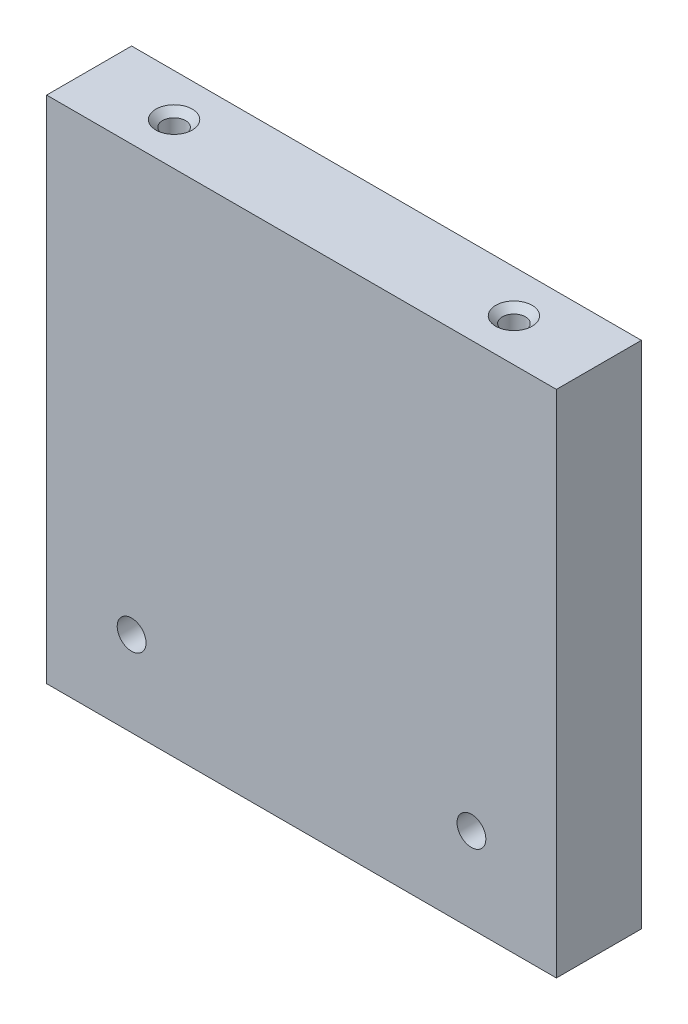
SolidWorks part; units mm, degrees
ref_plane "Front Plane" through (0, 0, 0) normal (0, 0, 1) x (1, 0, 0)
ref_plane "Top Plane" through (0, 0, 0) normal (0, 1, 0) x (1, 0, 0)
ref_plane "Right Plane" through (0, 0, 0) normal (1, 0, 0) x (0, 0, -1)
sketch "Sketch1" plane through (0, 0, 0) normal (0, 0, 1) x (1, 0, 0)
  line L1 (-83.6107, 61.7113) -> (-7.4107, 61.7113)
  line L2 (-83.6107, 61.7113) -> (-83.6107, -14.4887)
  line L3 (-83.6107, -14.4887) -> (-7.4107, -14.4887)
  line L4 (-7.4107, 61.7113) -> (-7.4107, -14.4887)
  line L5 (-83.6107, 61.7113) -> (-7.4107, -14.4887) construction
  line L6 (-83.6107, -14.4887) -> (-7.4107, 61.7113) construction
  point P0 (-45.5107, 23.6113)
  dimension "D1" = 76.2
  dimension "D2" = 76.2
extrude "Boss-Extrude1" add sketch "Sketch1" along normal blind 12.7 contours L2 L1 L4 L3
hole_wizard "#8-32 Tapped Hole2" positions "Sketch6" profile "Sketch5" tap size "#8-32" standard "ANSI Inch"
sketch "Sketch6" plane through (0, 61.7113, 0) normal (0, 1, 0) x (1, 0, 0)
  line L0 (-83.6107, 0) -> (-7.4107, 0) construction
  line L1 (-83.6107, -12.7) -> (-83.6107, 0) construction
  line L2 (-7.4107, -12.7) -> (-7.4107, 0) construction
  point P0 (-70.9107, -6.35)
  point P2 (-20.1107, -6.35)
  dimension "D1" = 6.35
  dimension "D2" = 12.7
  dimension "D3" = 6.35
  dimension "D4" = 12.7
sketch "Sketch5" plane through (-70.9107, 61.7113, 6.35) normal (1, 0, 0) x (0, 0, 1)
  line L0 (0, 0) -> (0, 7.3878)
  line L1 (0, 7.3878) -> (1.7272, 6.35)
  line L2 (1.7272, 6.35) -> (1.7272, 0.9906)
  line L3 (1.7272, 0.9906) -> (2.7178, 0)
  line L5 (2.7178, 0) -> (0, 0)
  line L6 (-1.7272, 0.9906) -> (-2.7178, 0) construction
  line L10 (0, 7.3878) -> (-1.7272, 6.35) construction
  line L11 (0, -6.35) -> (0, 107.95) construction
  dimension "Tap Drill Dia." = 3.4544
  dimension "Tap Drill Depth" = 6.35
  dimension "Near C'Sink Dia." = 5.4356
  dimension "Near C'Sink Angle" = 90
  dimension "Drill Angle" = 118
hole_wizard "CBORE for #8 Socket Head Cap Screw1" positions "Sketch7" profile "Sketch8" counterbore size "#8" standard "ANSI Inch"
sketch "Sketch7" plane through (0, 0, 0) normal (0, 0, -1) x (-1, 0, 0)
  line L0 (7.4107, 61.7113) -> (7.4107, -14.4887) construction
  line L1 (83.6107, -14.4887) -> (7.4107, -14.4887) construction
  line L2 (83.6107, 61.7113) -> (83.6107, -14.4887) construction
  point P0 (20.1107, -1.7887)
  point P2 (70.9107, -1.7887)
  dimension "D1" = 12.7
  dimension "D2" = 12.7
  dimension "D3" = 12.7
  dimension "D4" = 12.7
sketch "Sketch8" plane through (-20.1107, -1.7887, 0) normal (1, 0, 0) x (0, 1, 0)
  line L0 (0, 0) -> (0, 12.7)
  line L1 (0, 12.7) -> (2.1526, 12.7)
  line L3 (2.1526, 12.7) -> (2.1526, 4.1656)
  line L4 (3.9687, 4.1656) -> (2.1526, 4.1656)
  line L5 (3.9687, 4.1656) -> (3.9688, 0.635)
  line L6 (3.9688, 0.635) -> (4.6037, 0)
  line L7 (4.6037, 0) -> (0, 0)
  line L8 (-3.9688, 0.635) -> (-4.6037, 0) construction
  line L11 (0, -6.35) -> (0, 107.95) construction
  dimension "Thru Hole Dia." = 4.3053
  dimension "Thru Hole Depth" = 12.7
  dimension "C'Bore Dia." = 7.9375
  dimension "C'Bore Depth" = 4.1656
  dimension "Near C'Sink Dia." = 9.2075
  dimension "Near C'Sink Angle" = 90
equation "\"3.0inch\"=3.08749"
